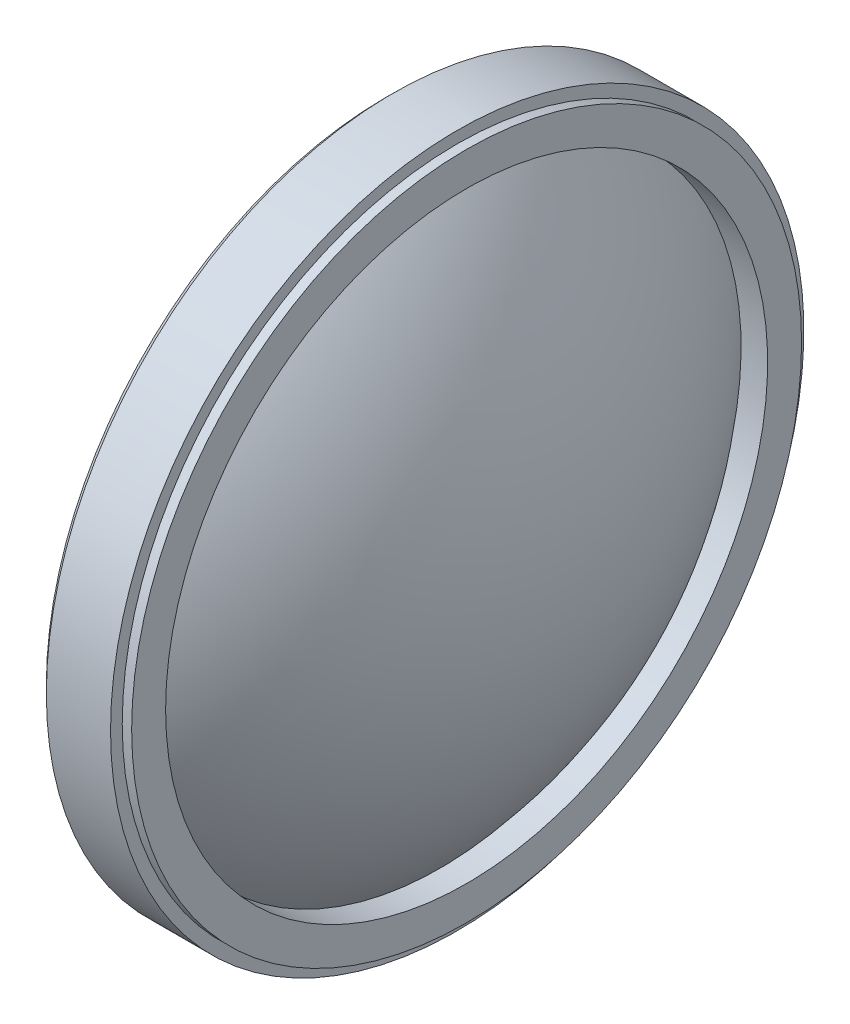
SolidWorks part; units mm, degrees
ref_plane "Front Plane" through (0, 0, 0) normal (0, 0, 1) x (1, 0, 0)
ref_plane "Top Plane" through (0, 0, 0) normal (0, 1, 0) x (1, 0, 0)
ref_plane "Right Plane" through (0, 0, 0) normal (1, 0, 0) x (0, 0, -1)
sketch "Sketch1" plane through (0, 0, 0) normal (0, 0, 1) x (1, 0, 0)
  line L5 (-3.9072, 0) -> (8.6754, 0) construction
  line L7 (2.5, -11.74) -> (2.5, -12.15)
  line L8 (0, 10.55) -> (0, 12.15)
  line L9 (0, 12.15) -> (2.5, 12.15)
  line L10 (1.9, 10.55) -> (2.83, 10.55)
  line L11 (2.83, 10.55) -> (2.83, 11.74)
  line L12 (2.83, 11.74) -> (2.5, 11.74)
  line L13 (2.5, 11.74) -> (2.5, 12.15)
  line L14 (2.83, -11.74) -> (2.5, -11.74)
  line L15 (2.83, -10.55) -> (2.83, -11.74)
  line L16 (1.9, -10.55) -> (2.83, -10.55)
  line L17 (0, -12.15) -> (2.5, -12.15)
  line L18 (0, -10.55) -> (0, -12.15)
  arc A0 (1.9, 10.55) -> (1.9, -10.55) centre (-10.0128, 0) cw
  arc A2 (0, 10.55) -> (0, -10.55) centre (-17.0504, 0) cw
revolve "Revolve1" add sketch "Sketch1" angle 360 about L5
chamfer "Chamfer1" distance 0.25 angle 45 1 edges at (0, 0, 12.15)
